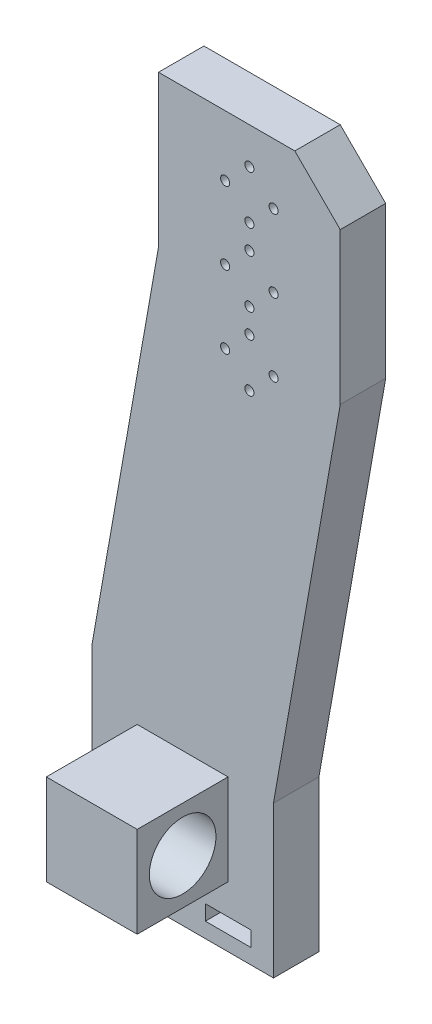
SolidWorks part; units mm, degrees
ref_plane "Alzado" through (0, 0, 0) normal (0, 0, 1) x (1, 0, 0)
ref_plane "Planta" through (0, 0, 0) normal (0, 1, 0) x (1, 0, 0)
ref_plane "Vista lateral" through (0, 0, 0) normal (1, 0, 0) x (0, 0, -1)
sketch "Croquis1" plane through (0, 0, 0) normal (0, 0, 1) x (1, 0, 0)
  line L0 (0, 0) -> (60, 0)
  line L1 (60, 0) -> (60, 50)
  line L2 (60, 50) -> (82.0409, 175)
  line L3 (82.0409, 175) -> (82.0409, 225)
  line L4 (82.0409, 225) -> (67.0409, 240)
  line L5 (67.0409, 240) -> (22.0409, 240)
  line L6 (22.0409, 240) -> (22.0409, 190)
  line L7 (22.0409, 190) -> (0, 65)
  line L8 (0, 65) -> (0, 0)
  line L9 (20.2891, 208) -> (91.3008, 208) construction
  line L10 (17.29, 184) -> (92.9559, 184) construction
  line L11 (30, -1.9057) -> (30, 26.7607) construction
  line L12 (7.5, 10) -> (22.5, 10)
  line L13 (7.5, 10) -> (7.5, 5)
  line L14 (7.5, 5) -> (22.5, 5)
  line L15 (22.5, 10) -> (22.5, 5)
  line L16 (37.5, 10) -> (37.5, 5)
  line L17 (52.5, 5) -> (37.5, 5)
  line L18 (52.5, 10) -> (52.5, 5)
  line L19 (52.5, 10) -> (37.5, 10)
  circle A0 centre (44.0409, 220) radius 1.5
  circle A6 centre (52.0409, 220) radius 8 construction
  circle A7 centre (52.0409, 228) radius 1.5
  circle A8 centre (60.0409, 220) radius 1.5
  circle A9 centre (52.0409, 212) radius 1.5
  circle A10 centre (52.0409, 204) radius 1.5
  circle A11 centre (60.0409, 196) radius 1.5
  circle A12 centre (52.0409, 188) radius 1.5
  circle A13 centre (44.0409, 196) radius 1.5
  circle A14 centre (52.0409, 180) radius 1.5
  circle A15 centre (60.0409, 172) radius 1.5
  circle A16 centre (52.0409, 164) radius 1.5
  circle A17 centre (44.0409, 172) radius 1.5
  point P16 (0, 0)
  point P37 (52.0409, 220)
  point P44 (0, 0)
  point P45 (0, 0)
  dimension "D11" = 3
  dimension "D12" = 16
  dimension "D18" = 20
  dimension "D1" = 240
  dimension "D2" = 60
  dimension "D3" = 170
  dimension "D4" = 50
  dimension "D5" = 50
  dimension "D6" = 45
  dimension "D7" = 50
  dimension "D8" = 65
  dimension "D9" = 170
  dimension "D10" = 15
  dimension "D13" = 30
  dimension "D14" = 4
  dimension "D15" = 8
  dimension "D16" = 20
  dimension "D17" = 12
  dimension "D19" = 15
  dimension "D20" = 5
  dimension "D21" = 7.5
  dimension "D22" = 5
  dimension "D23" = 30
  dimension "D24" = 8
  dimension "D25" = 12
extrude "Saliente-Extruir1" add sketch "Croquis1" along normal blind 15
sketch "Croquis4" plane through (0, 0, 15) normal (0, 0, 1) x (1, 0, 0)
  line L0 (60, 0) -> (60, 50) construction
  line L1 (15, 50) -> (45, 50)
  line L2 (15, 50) -> (15, 20)
  line L3 (15, 20) -> (45, 20)
  line L4 (45, 50) -> (45, 20)
  line L5 (0, 0) -> (60, 0) construction
  dimension "D1" = 30
  dimension "D2" = 30
  dimension "D3" = 15
  dimension "D4" = 20
extrude "Saliente-Extruir3" add sketch "Croquis4" along normal blind 30
sketch "Croquis5" plane through (15, 0, 0) normal (-1, 0, 0) x (0, 0, 1)
  line L0 (45, 50) -> (45, 20) construction
  line L1 (45, 50) -> (15, 50) construction
  circle A0 centre (30, 35) radius 11
  dimension "D1" = 22
  dimension "D2" = 15
  dimension "D3" = 15
extrude "Cortar-Extruir2" cut sketch "Croquis5" against normal blind 60
